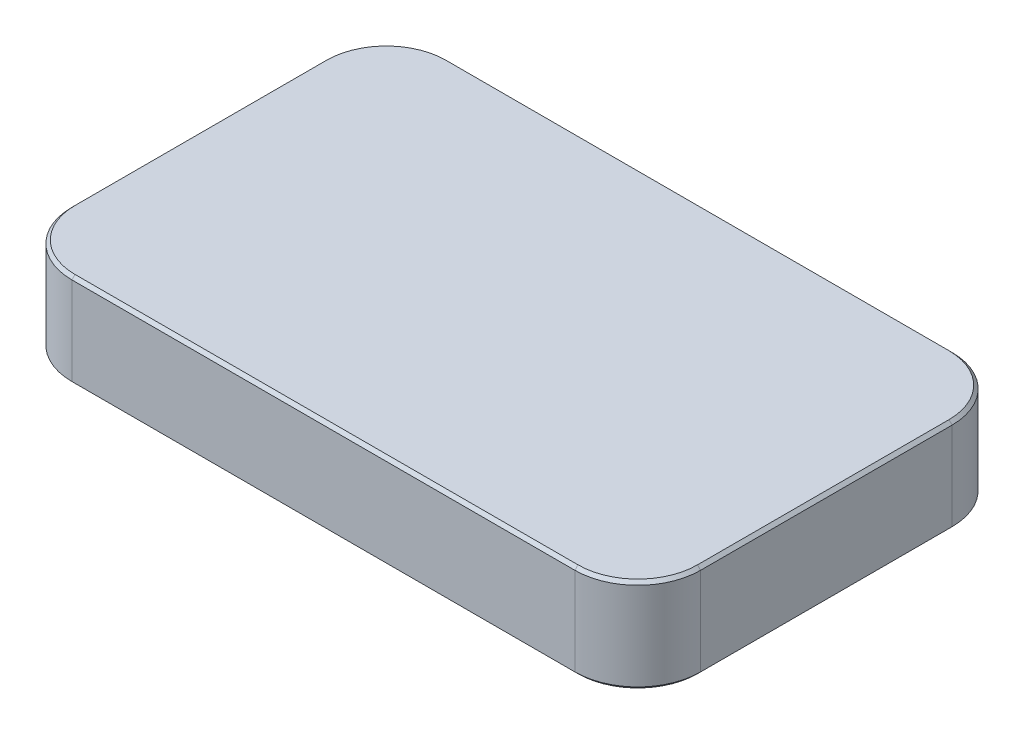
SolidWorks part; units mm, degrees
ref_plane "Plane1" through (0, 0, 0) normal (0, 0, 1) x (1, 0, 0)
ref_plane "Plane2" through (0, 0, 0) normal (0, 1, 0) x (1, 0, 0)
ref_plane "Plane3" through (0, 0, 0) normal (1, 0, 0) x (0, 0, -1)
sketch "Sketch1" plane through (0, 0, 0) normal (0, 1, 0) x (1, 0, 0)
  line L0 (-63.5, 38.1) -> (63.5, -38.1) construction
  line L1 (-63.5, 38.1) -> (63.5, 38.1)
  line L2 (-63.5, 38.1) -> (-63.5, -38.1)
  line L3 (-63.5, -38.1) -> (63.5, -38.1)
  line L4 (63.5, 38.1) -> (63.5, -38.1)
  dimension "D1" = 127
  dimension "D2" = 76.2
extrude "Extrude1" add sketch "Sketch1" along normal blind 19.05
fillet "Fillet1" radius 12.7 4 edges at (-63.5, 9.525, -38.1) (63.5, 9.525, -38.1) (-63.5, 9.525, 38.1) (63.5, 9.525, 38.1)
chamfer "Chamfer1" distance 0.635 angle 45 16 edges at (0, 0, 38.1) (63.5, 0, 0) (0, 0, -38.1) (-63.5, 0, 0) (0, 19.05, -38.1) (63.5, 19.05, 0) (0, 19.05, 38.1) (-63.5, 19.05, 0) (-59.7803, 0, 34.3803) (59.7803, 0, 34.3803) (59.7803, 0, -34.3803) (-59.7803, 0, -34.3803) (59.7803, 19.05, -34.3803) (59.7803, 19.05, 34.3803) (-59.7803, 19.05, 34.3803) (-59.7803, 19.05, -34.3803)
